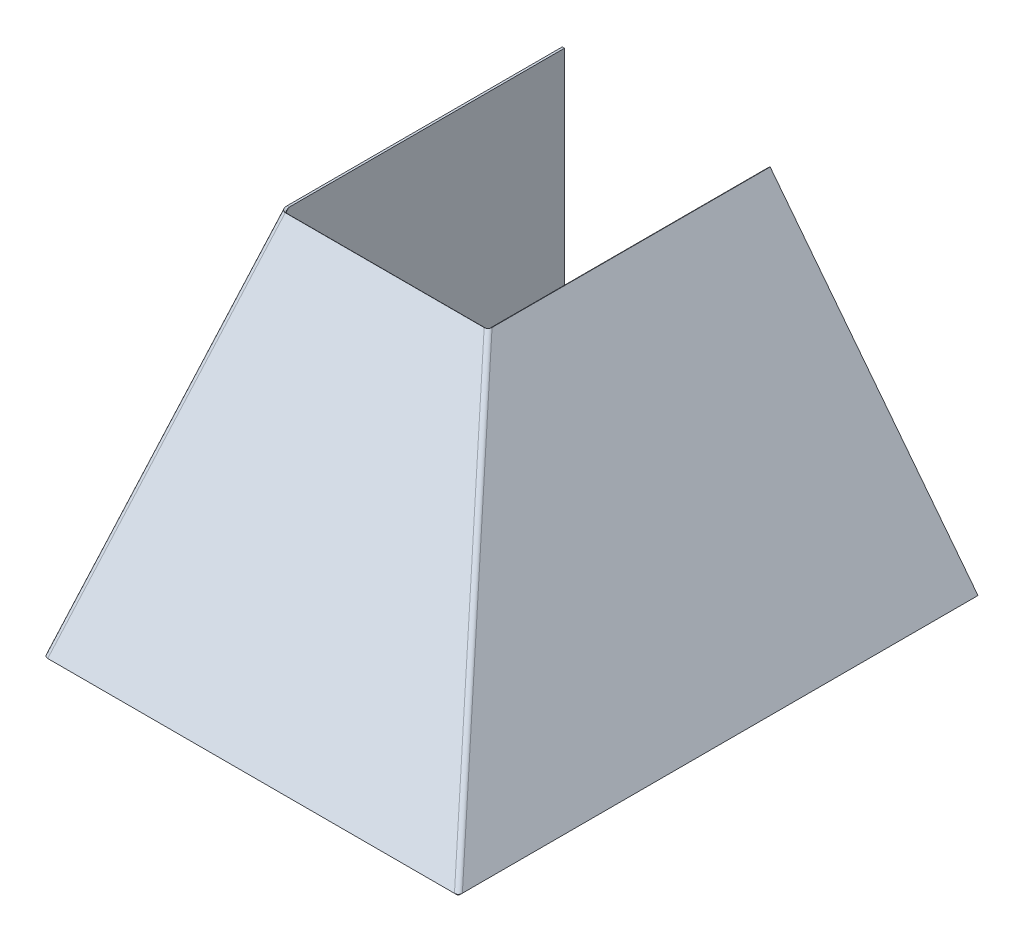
SolidWorks part; units mm, degrees
ref_plane "Plan de face" through (0, 0, 0) normal (0, 0, 1) x (1, 0, 0)
ref_plane "Plan de dessus" through (0, 0, 0) normal (0, 1, 0) x (1, 0, 0)
ref_plane "Plan de droite" through (0, 0, 0) normal (1, 0, 0) x (0, 0, -1)
sketch "Esquisse1" plane through (0, 0, 0) normal (0, 1, 0) x (1, 0, 0)
  line L0 (0, 350) -> (0, 0)
  line L1 (0, 0) -> (280, 0)
  line L2 (280, 0) -> (280, 350)
  dimension "D1" = 280
  dimension "D2" = 350
  dimension "D3" = 350
ref_plane "Plan1" through (0, 180, 0) normal (0, 1, 0) x (1, 0, 0)
sketch "Esquisse2" plane through (0, 180, 0) normal (0, 1, 0) x (1, 0, 0)
  line L0 (0, 350) -> (0, 160)
  line L1 (0, 350) -> (0, 0) construction
  line L2 (0, 160) -> (140, 160)
  line L3 (140, 160) -> (140, 350)
  dimension "D1" = 190
  dimension "D2" = 190
  dimension "D3" = 140
lofted bend "Plis de transition1" thickness 1.5 parameters "D1"=0, "D13"=0.5, "D15"=5, "D16"=30
bend "Pli issu d'un arrondi1" bend radius 1.95 bend angle 90 parameters "D5"=1
bend "Pli issu d'un arrondi2" bend radius 1.95 bend angle 65.928 parameters "D5"=2
sketch "Lignes de pliage1" plane through (0, 0, 0) normal (0, 1, 0) x (1, 0, 0)
sketch "Cube de visualisation1" plane through (0, 0, 0) normal (0, 1, 0) x (1, 0, 0)
sheet metal parameters "Tôlerie1" thickness 1.5 parameters "D1"=1.95
flat pattern "Etat déplié1"
sketch "Lignes de pliage2" plane through (173.2775, 134.7714, 0) normal (-0.7894, -0.6139, 0) x (0, 0, 1)
  line L0 (-1.4909, -171.1962) -> (-161.4909, 56.8389) construction
  line L1 (113.9764, 80.6651) -> (-104.6903, 181.5852) construction
  line L2 (-1.4909, -171.1962) -> (-161.4909, 56.8389) construction
  line L3 (113.9764, 80.6651) -> (-104.6903, 181.5852) construction
sketch3d "Cube de visualisation2" [suppressed]
  line L0 (-350, 413.6114, 0) -> (-350, -171.9034, 0) construction
  line L1 (114.5545, 413.6114, 0) -> (114.5545, -171.9034, 0) construction
  line L2 (-350, 413.6114, 0) -> (114.5545, 413.6114, 0) construction
  line L3 (-350, -171.9034, 0) -> (114.5545, -171.9034, 0) construction
bend of the flat pattern "Dépliage-<Pli issu d'un arrondi1>1"
bend of the flat pattern "Dépliage-<Pli issu d'un arrondi2>1"
